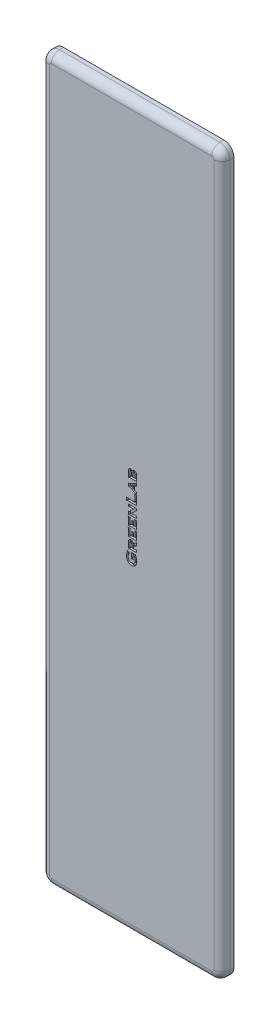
SolidWorks part; units mm, degrees
ref_plane "Front Plane" through (0, 0, 0) normal (0, 0, 1) x (1, 0, 0)
ref_plane "Top Plane" through (0, 0, 0) normal (0, 1, 0) x (1, 0, 0)
ref_plane "Right Plane" through (0, 0, 0) normal (1, 0, 0) x (0, 0, -1)
ref_plane "Plane1" through (0, 0, 3) normal (0, 0, 1) x (1, 0, 0)
sketch "Sketch1" plane through (0, 0, 3) normal (0, 0, 1) x (1, 0, 0)
  line L0 (-22.5, -67.5) -> (22.5, -67.5)
  line L1 (22.5, -67.5) -> (22.5, 112.5)
  line L2 (22.5, 112.5) -> (-22.5, 112.5)
  line L3 (-22.5, 112.5) -> (-22.5, -67.5)
  dimension "D1" = 45
  dimension "D2" = 180
extrude "Boss-Extrude1" add sketch "Sketch1" against normal blind 3
fillet "Fillet1" radius 2.5 4 edges at (22.5, -67.5, 1.5) (-22.5, -67.5, 1.5) (22.5, 112.5, 1.5) (-22.5, 112.5, 1.5)
fillet "Fillet2" radius 2 8 edges at (0, 112.5, 3) (21.7678, 111.7678, 3) (-21.7678, 111.7678, 3) (22.5, 22.5, 3) (-22.5, 22.5, 3) (21.7678, -66.7678, 3) (-21.7678, -66.7678, 3) (0, -67.5, 3)
sketch "Sketch2" plane through (0, 0, 3) normal (0, 0, 1) x (1, 0, 0)
  line L0 (1.25, 110.5) -> (1.25, -65.5) construction
  line L1 (20, 110.5) -> (-20, 110.5) construction
  line L2 (-20, -65.5) -> (20, -65.5) construction
  line L3 (22.5, 110) -> (22.5, -65) construction
  text T0 "GreenLab" font "Copperplate Gothic Bold" height 2.5
  dimension "D1" = 21.25
extrude "Cut-Extrude1" cut sketch "Sketch2" against normal blind 0.5
